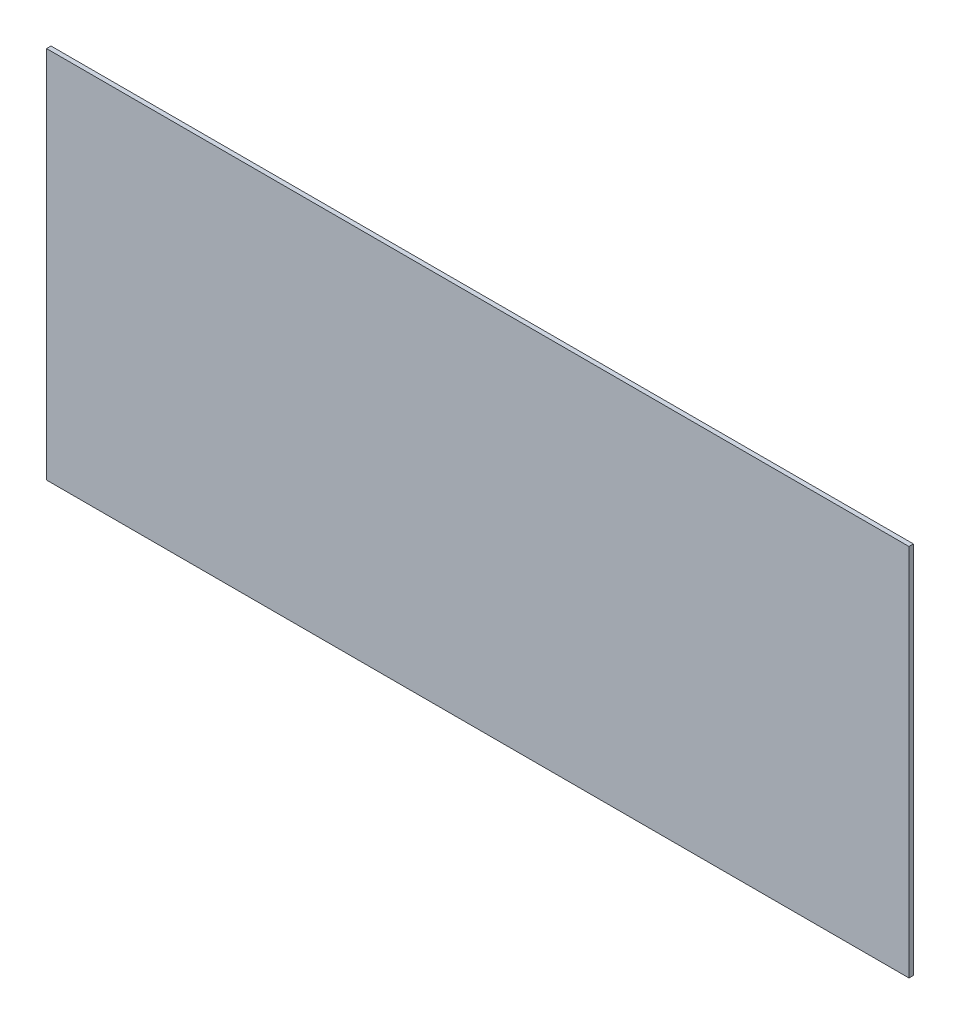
SolidWorks part; units mm, degrees
ref_plane "Front Plane" through (0, 0, 0) normal (1, 0, 0) x (0, 1, 0)
ref_plane "Top Plane" through (0, 0, 0) normal (0, 0, 1) x (0, 1, 0)
ref_plane "Right Plane" through (0, 0, 0) normal (0, 1, 0) x (-1, 0, 0)
sketch "Sketch1" plane through (0, 0, 0) normal (1, 0, 0) x (0, 1, 0)
  line L1 (-99.06, 76.2) -> (99.06, 76.2)
  line L2 (-99.06, 76.2) -> (-99.06, 78.5622)
  line L3 (-99.06, 78.5622) -> (99.06, 78.5622)
  line L4 (99.06, 76.2) -> (99.06, 78.5622)
extrude "Panel_or_block" add sketch "Sketch1" along normal blind 457.2
